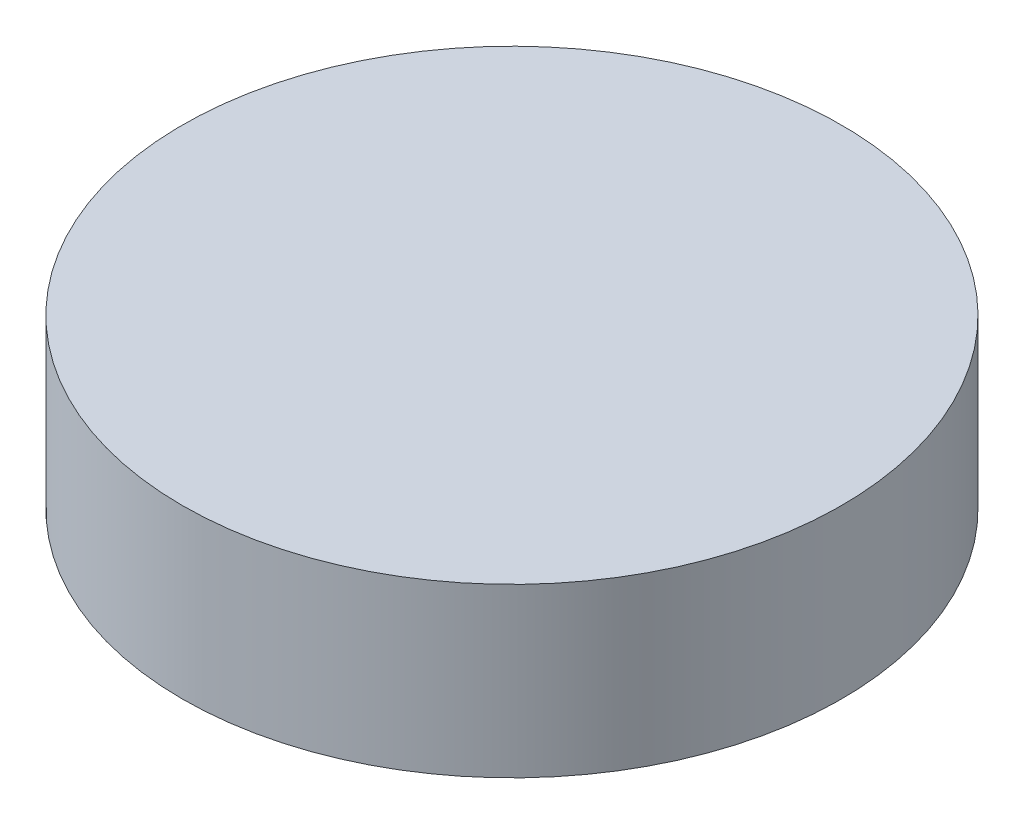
SolidWorks part; units mm, degrees
ref_plane "Front Plane" through (0, 0, 0) normal (0, 0, 1) x (1, 0, 0)
ref_plane "Top Plane" through (0, 0, 0) normal (0, 1, 0) x (1, 0, 0)
ref_plane "Right Plane" through (0, 0, 0) normal (1, 0, 0) x (0, 0, -1)
sketch "Sketch1" plane through (0, 0, 0) normal (0, 1, 0) x (1, 0, 0)
  circle A0 centre (0, 0) radius 29.5
  dimension "D1" = 59
extrude "Boss-Extrude1" add sketch "Sketch1" along normal blind 15
